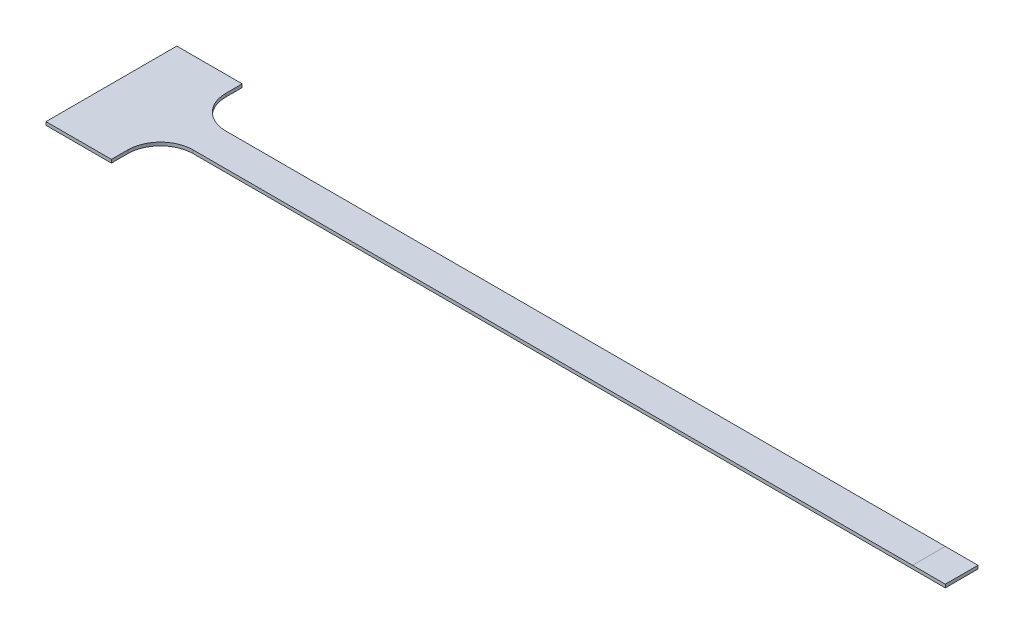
SolidWorks part; units mm, degrees
ref_plane "Front" through (0, 0, 0) normal (0, 0, 1) x (1, 0, 0)
ref_plane "Top" through (0, 0, 0) normal (0, 1, 0) x (1, 0, 0)
ref_plane "Right" through (0, 0, 0) normal (1, 0, 0) x (0, 0, -1)
sketch "Sketch1" plane through (0, 0, 0) normal (1, 0, 0) x (0, 0, -1)
  line L0 (0, 0) -> (23.4419, 0) construction
  line L1 (0, 0) -> (0, 15.8805) construction
  line L3 (-10, -1) -> (10, -1)
  line L4 (-10, -1) -> (-10, 1)
  line L5 (-10, 1) -> (10, 1)
  line L6 (10, -1) -> (10, 1)
  dimension "D1" = 20
  dimension "D2" = 10
  dimension "D3" = 2
  dimension "D4" = 1
extrude "Extrude1" add sketch "Sketch1" against normal blind 480
sketch "Sketch2" plane through (-480, 0, 0) normal (-1, 0, 0) x (0, 0, 1)
  line L1 (-40, -1) -> (40, -1)
  line L2 (-40, -1) -> (-40, 1)
  line L3 (-40, 1) -> (40, 1)
  line L4 (40, -1) -> (40, 1)
  line L6 (-10, 1) -> (10, 1) construction
  line L7 (10, -1) -> (-10, -1) construction
  line L8 (0, 0) -> (0, 18.7577) construction
  dimension "D1" = 80
  dimension "D2" = 40
extrude "Extrude2" add sketch "Sketch2" along normal blind 40
fillet "Fillet1" radius 20 2 edges
sketch "Sketch3" plane through (0, 1, 0) normal (0, 1, 0) x (-1, 0, 0)
  line L1 (460, 10) -> (0, 10) construction
  line L2 (0, -10) -> (20, -10)
  line L3 (0, -10) -> (0, 10)
  line L4 (0, 10) -> (20, 10)
  line L5 (20, -10) -> (20, 10)
  dimension "D1" = 20
